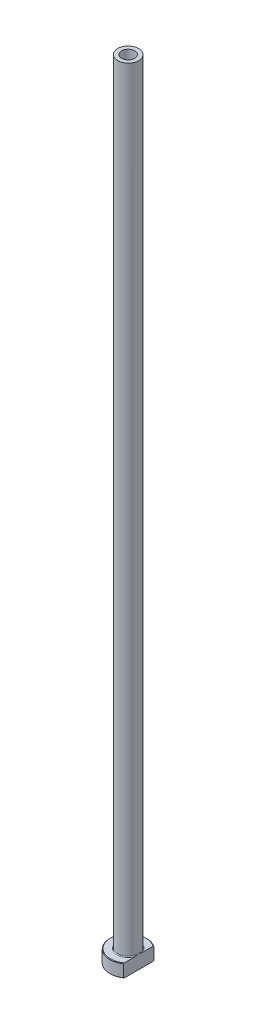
SolidWorks part; units mm, degrees
ref_plane "Front Plane" through (0, 0, 0) normal (0, 0, 1) x (1, 0, 0)
ref_plane "Top Plane" through (0, 0, 0) normal (0, 1, 0) x (1, 0, 0)
ref_plane "Right Plane" through (0, 0, 0) normal (1, 0, 0) x (0, 0, -1)
sketch "Sketch1" plane through (0, 0, 0) normal (0, 0, 1) x (1, 0, 0)
  line L0 (-2.5, 300) -> (-4, 300)
  line L1 (-4, 300) -> (-4, 5)
  line L2 (-4, 5) -> (-7, 5)
  line L3 (-7, 5) -> (-7, 0)
  line L4 (6.05, 0) -> (-6.05, 0) construction
  line L5 (-7, 0) -> (-2.75, 0)
  line L6 (-2.5, 255) -> (-2.5, 300)
  line L7 (0, 92.1877) -> (0, -15.5353) construction
  line L8 (0, -7.7) -> (0, 7.7) construction
  line L9 (-2.5, 255) -> (-2.75, 243)
  line L10 (-2.75, 243) -> (-2.75, 0)
  dimension "D1" = 0.25
  dimension "ID" = 5
  dimension "OD" = 8
  dimension "L" = 300
  dimension "H" = 14
  dimension "T" = 5
  dimension "N" = 45
  dimension "D2" = 12
  dimension "L-N" = 255
revolve "Revolve1" add sketch "Sketch1" angle 360 about L7
fillet "Fillet1" radius 0.3 1 edges at (0, 5, 4)
chamfer "Chamfer1" distance 0.2 angle 45 2 edges at (0, 5, 7) (0, 0, 7)
sketch "Sketch2" plane through (0, 0, 0) normal (0, -1, 0) x (1, 0, 0)
  line L0 (4, 5.7446) -> (4, -5.7446)
  circle A0 centre (0, 0) radius 7 construction
  arc A1 (4, 5.7446) -> (4, -5.7446) centre (0, 0) cw
  circle A2 centre (0, 0) radius 4 construction
extrude "Cut-Extrude1" cut sketch "Sketch2" against normal through all
chamfer "Chamfer2" distance 0.5 angle 45 1 edges at (0, 0, 2.75)
